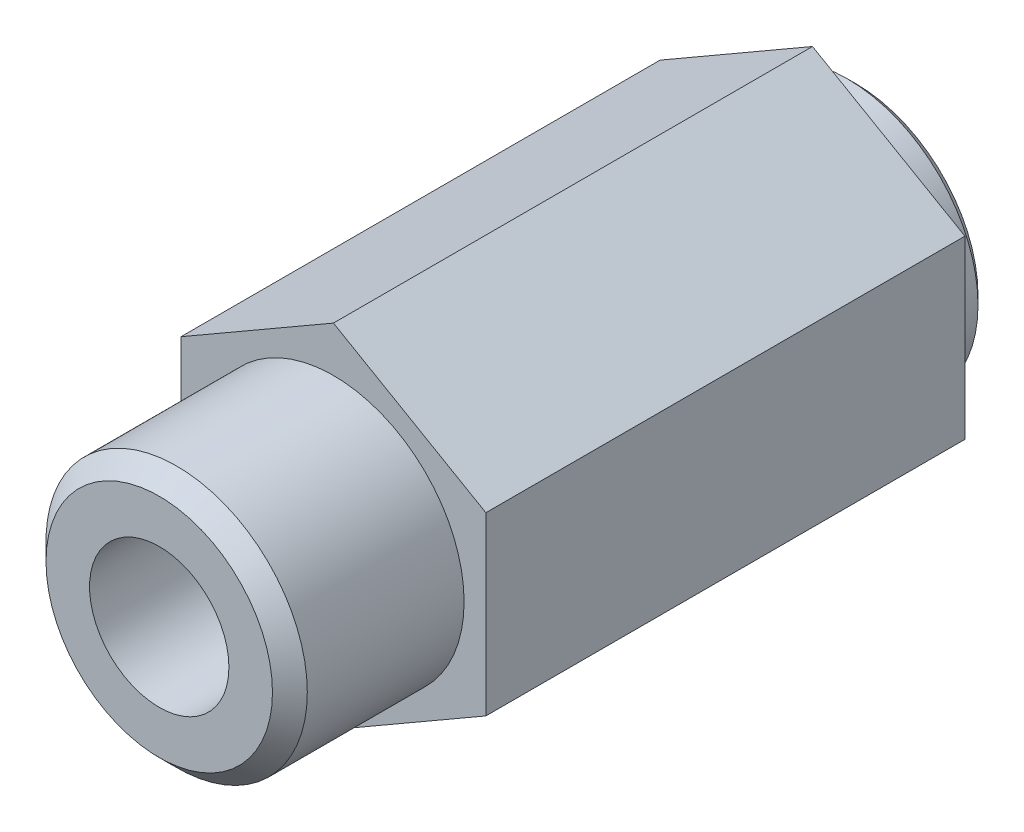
SolidWorks part; units mm, degrees
ref_plane "前视基准面" through (0, 0, 0) normal (0, 0, 1) x (1, 0, 0)
ref_plane "上视基准面" through (0, 0, 0) normal (0, 1, 0) x (1, 0, 0)
ref_plane "右视基准面" through (0, 0, 0) normal (1, 0, 0) x (0, 0, -1)
sketch "草图1" plane through (0, 0, 0) normal (0, 0, 1) x (1, 0, 0)
  line L1 (0, 20.2073) -> (-17.5, 10.1036)
  line L2 (-17.5, 10.1036) -> (-17.5, -10.1036)
  line L3 (-17.5, -10.1036) -> (0, -20.2073)
  line L4 (0, -20.2073) -> (17.5, -10.1036)
  line L5 (17.5, -10.1036) -> (17.5, 10.1036)
  line L6 (17.5, 10.1036) -> (0, 20.2073)
  circle A0 centre (0, 0) radius 17.5 construction
extrude "凸台-拉伸1" add sketch "草图1" along normal blind 55
sketch "草图2" plane through (0, 0, 55) normal (0, 0, 1) x (1, 0, 0)
  circle A0 centre (0, 0) radius 15
extrude "凸台-拉伸3" add sketch "草图2" along normal blind 20
sketch "草图3" plane through (0, 0, 0) normal (0, 0, -1) x (-1, 0, 0)
  circle A0 centre (0, 0) radius 15
extrude "凸台-拉伸4" add sketch "草图3" along normal blind 5
sketch "草图4" plane through (0, 0, -5) normal (0, 0, -1) x (-1, 0, 0)
  circle A0 centre (0, 0) radius 10
extrude "切除-拉伸1" cut sketch "草图4" against normal blind 40
sketch "草图5" plane through (0, 0, 75) normal (0, 0, 1) x (1, 0, 0)
  circle A0 centre (0, 0) radius 8
extrude "切除-拉伸2" cut sketch "草图5" against normal blind 40
chamfer "倒角1" distance 2 angle 45 1 edges at (15, 0, 75)
chamfer "倒角2" distance 1 angle 45 1 edges at (-15, 0, -5)
